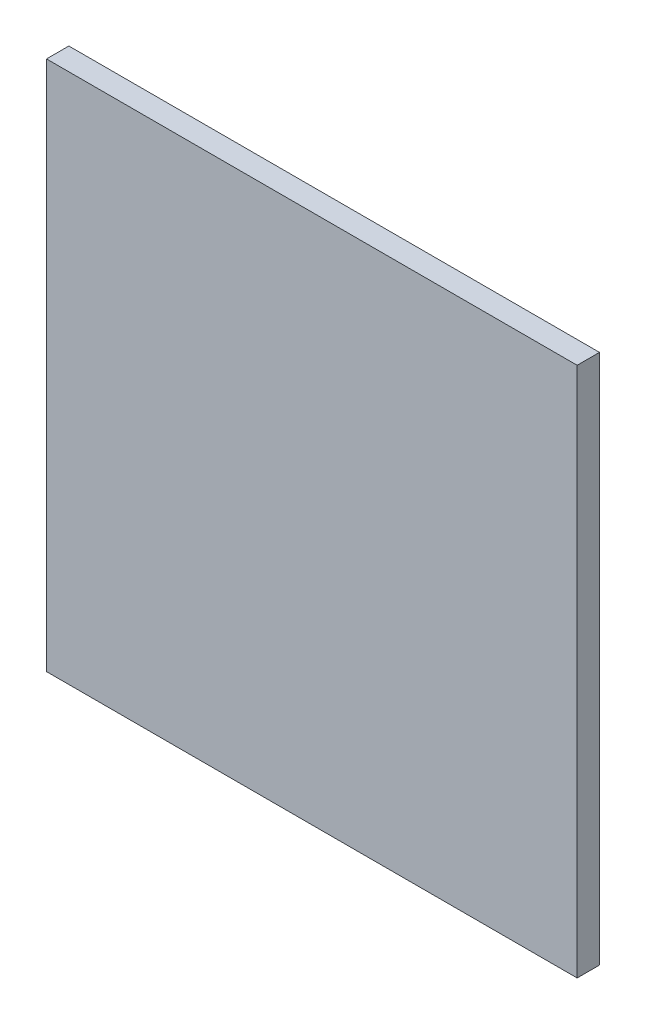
SolidWorks part; units mm, degrees
ref_plane "Plan de face" through (0, 0, 0) normal (0, 0, 1) x (1, 0, 0)
ref_plane "Plan de dessus" through (0, 0, 0) normal (0, 1, 0) x (1, 0, 0)
ref_plane "Plan de droite" through (0, 0, 0) normal (1, 0, 0) x (0, 0, -1)
sketch "Esquisse1" plane through (0, 0, 0) normal (0, 0, 1) x (1, 0, 0)
  line L1 (0, 0) -> (19, 0)
  line L2 (0, 0) -> (0, 19)
  line L3 (0, 19) -> (19, 19)
  line L4 (19, 0) -> (19, 19)
  dimension "D1" = 19
  dimension "D2" = 19
extrude "Extrusion1" add sketch "Esquisse1" along normal blind 0.8
